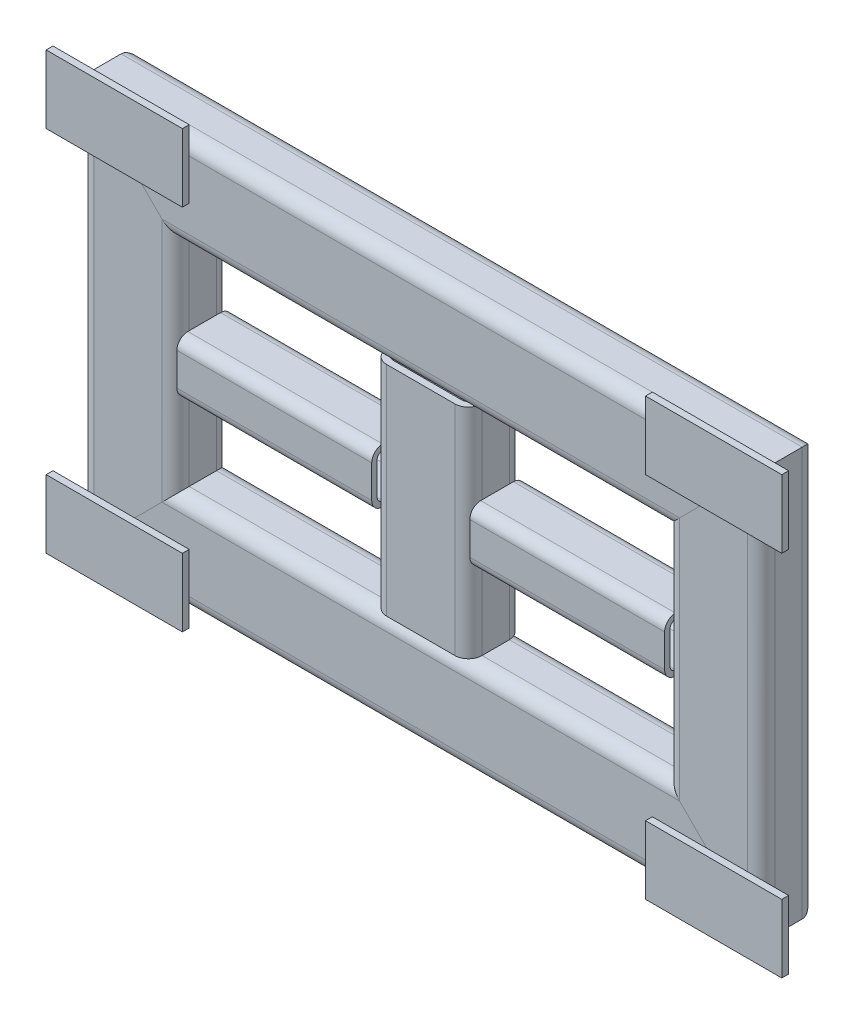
SolidWorks part; units mm, degrees
ref_plane "Płaszczyzna przednia" through (0, 0, 0) normal (0, 0, 1) x (1, 0, 0)
ref_plane "Płaszczyzna górna" through (0, 0, 0) normal (0, 1, 0) x (1, 0, 0)
ref_plane "Płaszczyzna prawa" through (0, 0, 0) normal (1, 0, 0) x (0, 0, -1)
sketch "Szkic1" plane through (0, 0, 0) normal (0, 0, 1) x (1, 0, 0)
  line L0 (0, 150) -> (0, -150)
  line L1 (250, -150) -> (-250, -150)
  line L2 (250, -150) -> (250, 150)
  line L3 (250, 150) -> (-250, 150)
  line L4 (-250, -150) -> (-250, 150)
  line L5 (250, -150) -> (-250, 150) construction
  line L6 (250, 150) -> (-250, -150) construction
  line L7 (-250, 0) -> (250, 0)
  point P0 (0, 0)
  dimension "D1" = 300
  dimension "D2" = 500
other "Rura prostokątna 70 X 40 X 5(1)"
ref_plane "Płaszczyzna1" through (-215, -150, 0) normal (0, 1, 0) x (0, 0, 1)
sketch "Sketch1" plane through (-250, -150, 0) normal (0, 1, 0) x (0, 0, 1)
  line L0 (-10, -30) -> (10, -30)
  line L1 (-15, -25) -> (-15, 25)
  line L2 (10, 30) -> (-10, 30)
  line L3 (15, 25) -> (15, -25)
  line L4 (-10, -35) -> (10, -35)
  line L5 (-20, -25) -> (-20, 25)
  line L6 (10, 35) -> (-10, 35)
  line L7 (20, 25) -> (20, -25)
  arc A0 (20, 25) -> (10, 35) centre (10, 25) ccw
  arc A1 (10, -35) -> (20, -25) centre (10, -25) ccw
  arc A2 (-20, -25) -> (-10, -35) centre (-10, -25) ccw
  arc A3 (-10, 35) -> (-20, 25) centre (-10, 25) ccw
  arc A4 (-10, 30) -> (-15, 25) centre (-10, 25) ccw
  arc A5 (15, 25) -> (10, 30) centre (10, 25) ccw
  arc A6 (10, -30) -> (15, -25) centre (10, -25) ccw
  arc A7 (-15, -25) -> (-10, -30) centre (-10, -25) ccw
  point P0 (0, 35)
  point P1 (20, 0)
  point P2 (0, -35)
  point P3 (-20, 0)
  point P4 (-20, 35)
  point P5 (20, 35)
  point P6 (20, -35)
  point P7 (-20, -35)
  point P8 (0, 0)
  point P33 (0, 0)
  dimension "D1" = 10
  dimension "Thickness" = 5
  dimension "V_leg" = 70
  dimension "H_leg" = 40
other "Rura kwadratowa 40 X 40 X 4(1)"
ref_plane "Płaszczyzna2" through (-250, 0, 0) normal (1, 0, 0) x (0, 1, 0)
sketch "Sketch11" plane through (-250, 0, 0) normal (1, 0, 0) x (0, 1, 0)
  line L0 (-12, -16) -> (12, -16)
  line L1 (-16, -12) -> (-16, 12)
  line L2 (12, 16) -> (-12, 16)
  line L3 (16, 12) -> (16, -12)
  line L4 (-12, -20) -> (12, -20)
  line L5 (-20, -12) -> (-20, 12)
  line L6 (12, 20) -> (-12, 20)
  line L7 (20, 12) -> (20, -12)
  arc A0 (20, 12) -> (12, 20) centre (12, 12) ccw
  arc A1 (12, -20) -> (20, -12) centre (12, -12) ccw
  arc A2 (-20, -12) -> (-12, -20) centre (-12, -12) ccw
  arc A3 (-12, 20) -> (-20, 12) centre (-12, 12) ccw
  arc A4 (-12, 16) -> (-16, 12) centre (-12, 12) ccw
  arc A5 (16, 12) -> (12, 16) centre (12, 12) ccw
  arc A6 (12, -16) -> (16, -12) centre (12, -12) ccw
  arc A7 (-16, -12) -> (-12, -16) centre (-12, -12) ccw
  point P0 (-20, 0)
  point P1 (20, 0)
  point P2 (0, 20)
  point P3 (0, -20)
  point P4 (0, 0)
  point P5 (-20, -20)
  point P6 (20, -20)
  point P7 (20, 20)
  point P8 (-20, 20)
  point P33 (0, 0)
  dimension "D1" = 8
  dimension "Thickness" = 4
  dimension "V_leg" = 40
other "Przytnij/Wydłuż1"
sketch "Szkic4" plane through (0, 0, 20) normal (0, 0, 1) x (1, 0, 0)
  line L0 (-250, 150) -> (-250, -150) construction
  line L1 (-270, 160) -> (-170, 160)
  line L2 (-270, 160) -> (-270, 110)
  line L3 (-270, 110) -> (-170, 110)
  line L4 (-170, 160) -> (-170, 110)
  line L5 (250, 150) -> (-250, 150) construction
  dimension "D1" = 50
  dimension "D2" = 100
  dimension "D3" = 20
  dimension "D4" = 10
extrude "Dodanie-wyciągnięcie1" add sketch "Szkic4" along normal blind 5 separate body
mirror "Lustro1" about plane through (0, 0, 0) normal (1, 0, 0)
mirror "Lustro2" about plane through (0, 0, 0) normal (0, 1, 0)
